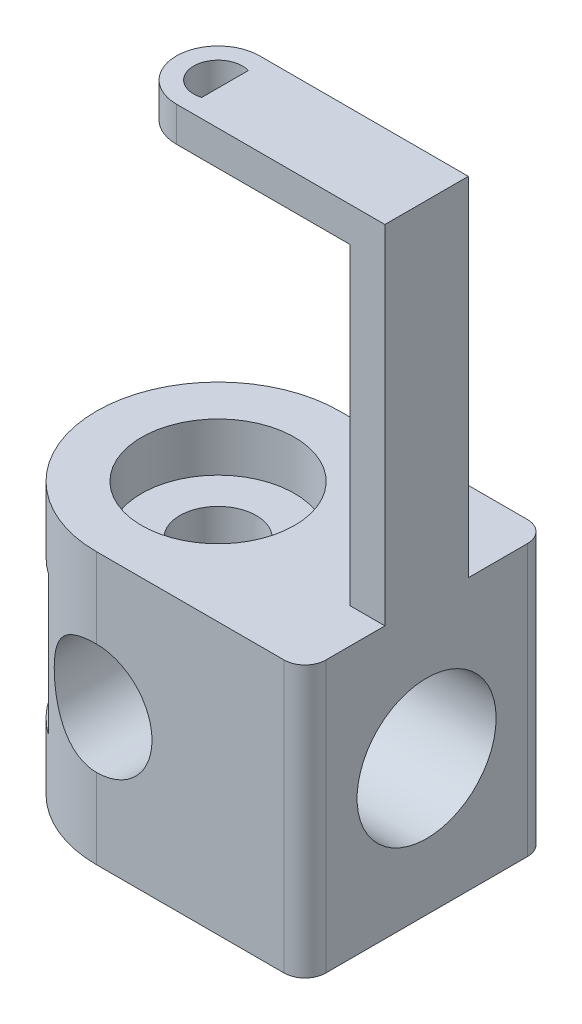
SolidWorks part; units mm, degrees
other "Body[1]"
ref_plane "Front Plane" through (0, 0, 0) normal (0, 0, 1) x (1, 0, 0)
ref_plane "Top Plane" through (0, 0, 0) normal (0, 1, 0) x (1, 0, 0)
ref_plane "Right Plane" through (0, 0, 0) normal (1, 0, 0) x (0, 0, -1)
imported_body "motor joint v4-Body.step<1>"
sketch "Sketch1" plane through (0, 19.5, 0) normal (0, 1, 0) x (1, 0, 0)
  line L0 (15, 14.5) -> (15, -14.5) construction
  line L1 (15, -6) -> (10, -6)
  line L2 (15, -6) -> (15, 6)
  line L3 (15, 6) -> (10, 6)
  line L4 (10, -6) -> (10, 6)
  point P10 (10, 0)
  dimension "D1" = 5
  dimension "D2" = 12
extrude "Boss-Extrude1" add sketch "Sketch1" along normal blind 45
sketch "Sketch2" plane through (0, 64.5, 0) normal (0, 1, 0) x (1, 0, 0)
  line L1 (-15, 6) -> (15, 6)
  line L3 (-15, -6) -> (15, -6)
  line L4 (15, 6) -> (15, -6)
  arc A1 (-15, -6) -> (-15, 6) centre (-15, 0) cw
extrude "Boss-Extrude2" add sketch "Sketch2" along normal blind 5
sketch "Sketch3" plane through (0, 69.5, 0) normal (0, 1, 0) x (1, 0, 0)
  line L0 (-18.5, 0) -> (-14, 0) construction
  line L1 (-14, 0) -> (-14, 3.3541)
  line L2 (-14, 0) -> (-14, -3.3541)
  arc A0 (-14, 3.3541) -> (-14, -3.3541) centre (-15, 0) ccw
  dimension "D1" = 4.5
extrude "Cut-Extrude1" cut sketch "Sketch3" against normal blind 5
